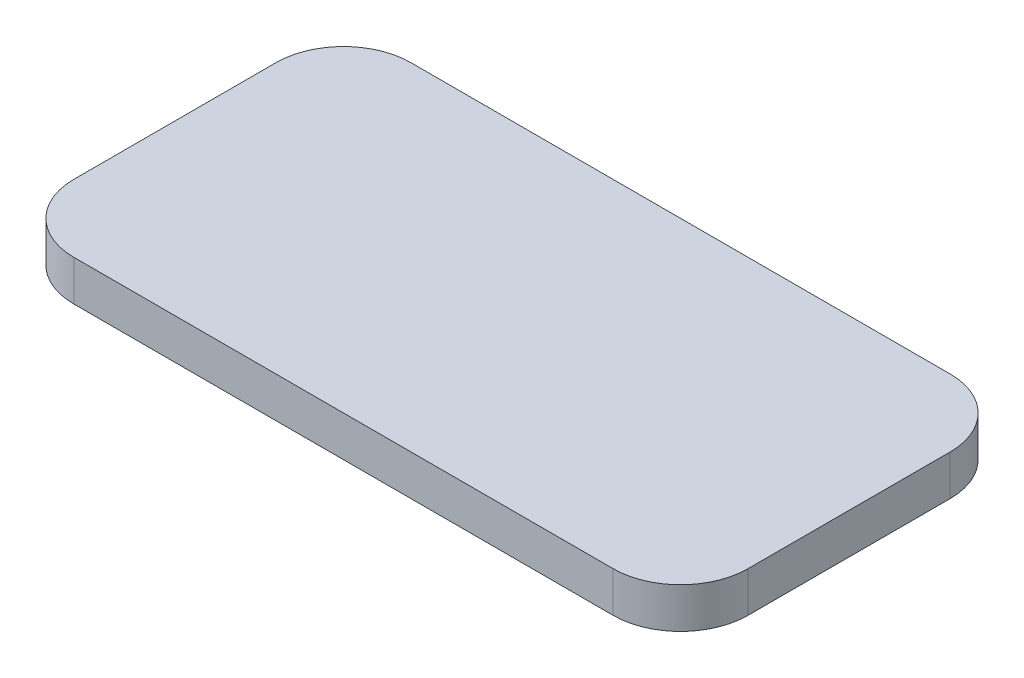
SolidWorks part; units mm, degrees
ref_plane "Front" through (0, 0, 0) normal (0, 0, 1) x (1, 0, 0)
ref_plane "Top" through (0, 0, 0) normal (0, 1, 0) x (1, 0, 0)
ref_plane "Right" through (0, 0, 0) normal (1, 0, 0) x (0, 0, -1)
sketch "Sketch1" plane through (0, 0, 0) normal (0, 1, 0) x (1, 0, 0)
  line L1 (5, 0) -> (45, 0)
  line L2 (0, 5) -> (0, 20)
  line L3 (5, 25) -> (45, 25)
  line L4 (50, 5) -> (50, 20)
  arc A0 (5, 25) -> (0, 20) centre (5, 20) ccw
  arc A1 (50, 5) -> (45, 0) centre (45, 5) cw
  arc A2 (50, 20) -> (45, 25) centre (45, 20) ccw
  arc A3 (0, 5) -> (5, 0) centre (5, 5) ccw
  point P13 (0, 0)
  dimension "D1" = 5
  dimension "D2" = 25
  dimension "D3" = 50
extrude "Extrude1" add sketch "Sketch1" along normal blind 3
sketch "Sketch2" plane through (0, 3, 0) normal (0, 1, 0) x (-1, 0, 0)
  circle A0 centre (-5, -20) radius 2.5
  arc A1 (-5, -25) -> (0, -20) centre (-5, -20) ccw construction
  dimension "D1" = 5
